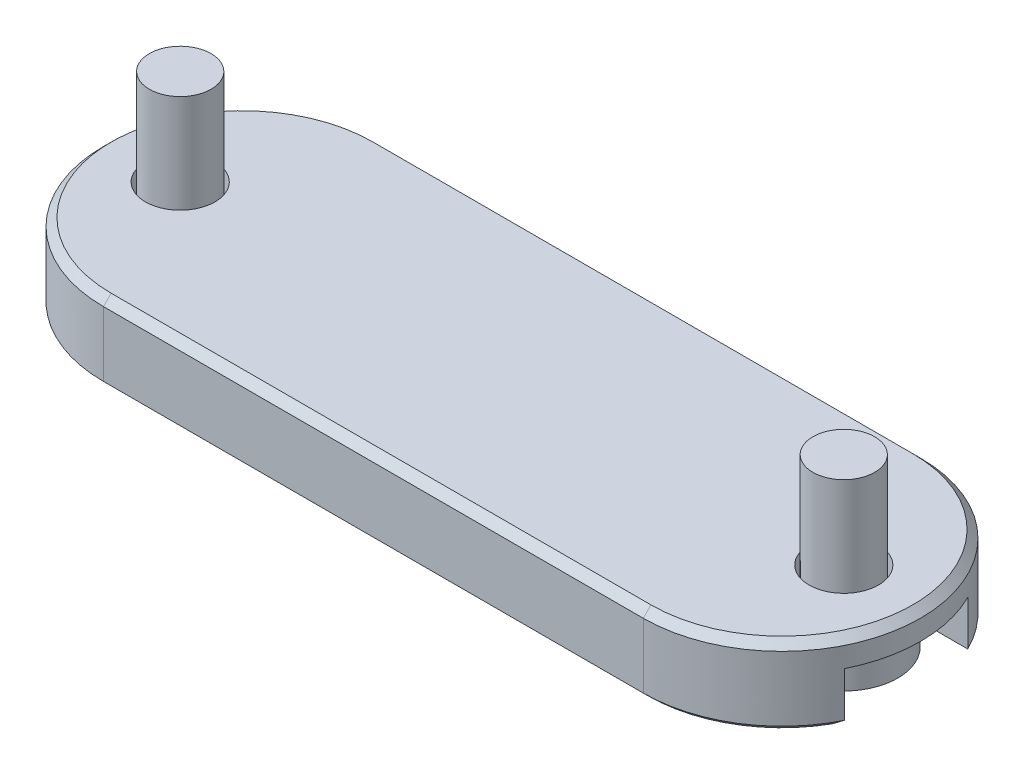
SolidWorks part; units mm, degrees
other "<LHCSM4-.7L8>-<HEX>"
ref_plane "Front Plane" through (0, 0, 0) normal (0, 0, 1) x (1, 0, 0)
ref_plane "Top Plane" through (0, 0, 0) normal (0, 1, 0) x (1, 0, 0)
ref_plane "Right Plane" through (0, 0, 0) normal (1, 0, 0) x (0, 0, -1)
sketch "Sketch1" plane through (0, 0, 0) normal (0, 1, 0) x (1, 0, 0)
  line L0 (0, 6.99) -> (0, -6.99) construction
  line L1 (-17.49, 8.985) -> (17.49, 8.985)
  line L3 (-17.49, -8.985) -> (17.49, -8.985)
  line L5 (-9.5545, 0) -> (8.6705, 0) construction
  arc A0 (-17.49, 8.985) -> (-17.49, -8.985) centre (-17.49, 0) ccw
  arc A1 (17.49, -8.985) -> (17.49, 8.985) centre (17.49, 0) ccw
  circle A2 centre (-21.5, 0) radius 2.25
  circle A3 centre (21.5, 0) radius 2.25
  dimension "D3" = 43
  dimension "D1" = 52.95
  dimension "D4" = 4.5
  dimension "D2" = 17.97
extrude "Boss-Extrude1" add sketch "Sketch1" along normal blind 5
sketch "Sketch4" plane through (0, 0, 0) normal (1, 0, 0) x (0, 0, -1)
  line L2 (0, -0.0283) -> (0, 5) construction
  line L3 (0, 5) -> (0, 0) construction
  line L4 (-2.8942, 0) -> (2.8942, 0)
  line L5 (8.985, 5) -> (-8.985, 5) construction
  line L7 (0, 5) -> (0, 0) construction
  line L8 (-8.985, 0) -> (8.985, 0) construction
  line L9 (2.8942, 0) -> (0.7071, 2.1871)
  line L10 (-0.7071, 2.1871) -> (-2.8942, 0)
  arc A7 (0.7071, 2.1871) -> (-0.7071, 2.1871) centre (0, 1.48) ccw
  dimension "D5" = 1
  dimension "D7" = 2.48
  dimension "D6" = 90
extrude "Cut-Extrude2" cut sketch "Sketch4" against normal through all both and the other way through all
sketch "Sketch3" plane through (0, 0, 0) normal (0, 1, 0) x (1, 0, 0)
  line L0 (-21.5, 4) -> (-28, 4)
  line L1 (-28, 4) -> (-28, -4)
  line L2 (-28, -4) -> (-21.5, -4)
  line L3 (21.5, 4) -> (28, 4)
  line L4 (28, 4) -> (28, -4)
  line L5 (28, -4) -> (21.5, -4)
  arc A0 (-21.5, -4) -> (-21.5, 4) centre (-21.5, 0) ccw
  arc A1 (21.5, 4) -> (21.5, -4) centre (21.5, 0) ccw
  dimension "D1" = 8
  dimension "D2" = 28
  dimension "D3" = 28
extrude "Cut-Extrude1" cut sketch "Sketch3" along normal blind 3.2
fillet "Fillet1" radius 0.5 2 edges at (0, 0, -2.8942) (0, 0, 2.8942)
chamfer "Chamfer1" distance 0.3 angle 45 24 edges at (-22.2223, 0, 7.6377) (22.2223, 0, 7.6377) (0, 0, 8.985) (-22.2223, 0, -7.6377) (0, 0, -8.985) (22.2223, 0, -7.6377) (23.5178, 0, -4) (20.1593, 0, -3.7686) (18.7561, 0.0379, -2.9105) (17.9292, 1.0916, -1.8026) (17.5002, 2.4793, 0.0379) (17.9292, 1.0916, 1.8026) (18.713, 0.0571, 2.8693) (20.1593, 0, 3.7686) (23.5178, 0, 4) (-23.5178, 0, -4) (-20.1593, 0, -3.7686) (-18.713, 0.0571, -2.8693) (-17.9292, 1.0916, -1.8026) (-17.5067, 2.4527, -0.232) (-17.9292, 1.0916, 1.8026) (-18.7561, 0.0379, 2.9105) (-20.1593, 0, 3.7686) (-23.5178, 0, 4)
chamfer "Chamfer2" distance 0.5 angle 45 4 edges at (0, 5, -8.985) (-26.475, 5, 0) (26.475, 5, 0) (0, 5, 8.985)
inserted part "LHCSM4-.7L8"
move or copy body "Body-Move/Copy2" placed by mates yes parameters "D1"=0, "D2"=0, "D3"=0
mirror "Mirror1" about plane through (0, 0, 0) normal (1, 0, 0)
